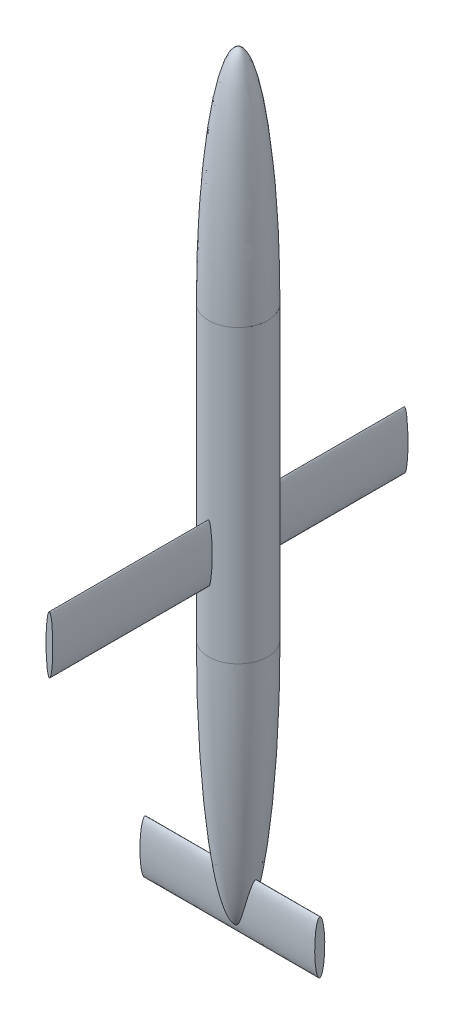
SolidWorks part; units mm, degrees
ref_plane "Front Plane" through (0, 0, 0) normal (0, 0, 1) x (1, 0, 0)
ref_plane "Top Plane" through (0, 0, 0) normal (0, 1, 0) x (1, 0, 0)
ref_plane "Right Plane" through (0, 0, 0) normal (1, 0, 0) x (0, 0, -1)
sketch "Sketch1" plane through (0, 0, 0) normal (0, 0, 1) x (1, 0, 0)
  line L0 (0, 0) -> (101.6, 0)
  line L1 (0.1027, 762) -> (0, 0)
  ellipse E0 centre (0, 0) end of major axis (0.1027, 762) minor radius 101.6 (0.1027, 762) -> (101.6, 0) cw
  dimension "D1" = 101.6
  dimension "D2" = 762
revolve "Revolve1" add sketch "Sketch1" angle 360 about L1
sketch "Sketch2" plane through (0, 0, 0) normal (0, 1, 0) x (1, 0, 0)
  circle A0 centre (0, 0) radius 101.6
  dimension "D1" = 203.2
extrude "Boss-Extrude1" add sketch "Sketch2" against normal blind 1000 separate body
ref_plane "Plane1" through (0, -500, 0) normal (0, -1, 0) x (-1, 0, 0)
sketch "Sketch3" plane through (0, 0, 0) normal (0, 0, 1) x (1, 0, 0)
  line L0 (-101.6, -1000) -> (101.6, -1000) construction
  line L1 (0, -1846.4747) -> (0, -1000)
  line L2 (0, -1000) -> (101.6, -1000)
  ellipse E0 centre (0, -1000) end of major axis (0, -153.5253) minor radius 101.6 (0, -1846.4747) -> (101.6, -1000) ccw
revolve "Revolve2" add sketch "Sketch3" angle 360 about L1
ref_plane "Plane2" through (0, 0, 140) normal (0, 0, 1) x (1, 0, 0)
sketch "Sketch4" plane through (0, 0, 140) normal (0, 0, 1) x (1, 0, 0)
  ellipse E0 centre (0, -691.2363) end of major axis (0, -592.8837) minor radius 11.6934
extrude "Boss-Extrude2" add sketch "Sketch4" against normal blind 1219.2 from offset 508
ref_plane "Plane3" through (0, 0, -140) normal (0, 0, 1) x (1, 0, 0)
ref_plane "Plane4" through (0, 0, 0) normal (0, 0, 1) x (1, 0, 0)
ref_plane "Plane5" through (280, 0, 0) normal (1, 0, 0) x (0, 0, -1)
sketch "Sketch5" plane through (280, 0, 0) normal (1, 0, 0) x (0, 0, -1)
  ellipse E0 centre (0, -1774.544) end of major axis (0, -1865.1639) minor radius 17.3256
extrude "Boss-Extrude3" add sketch "Sketch5" against normal blind 600
